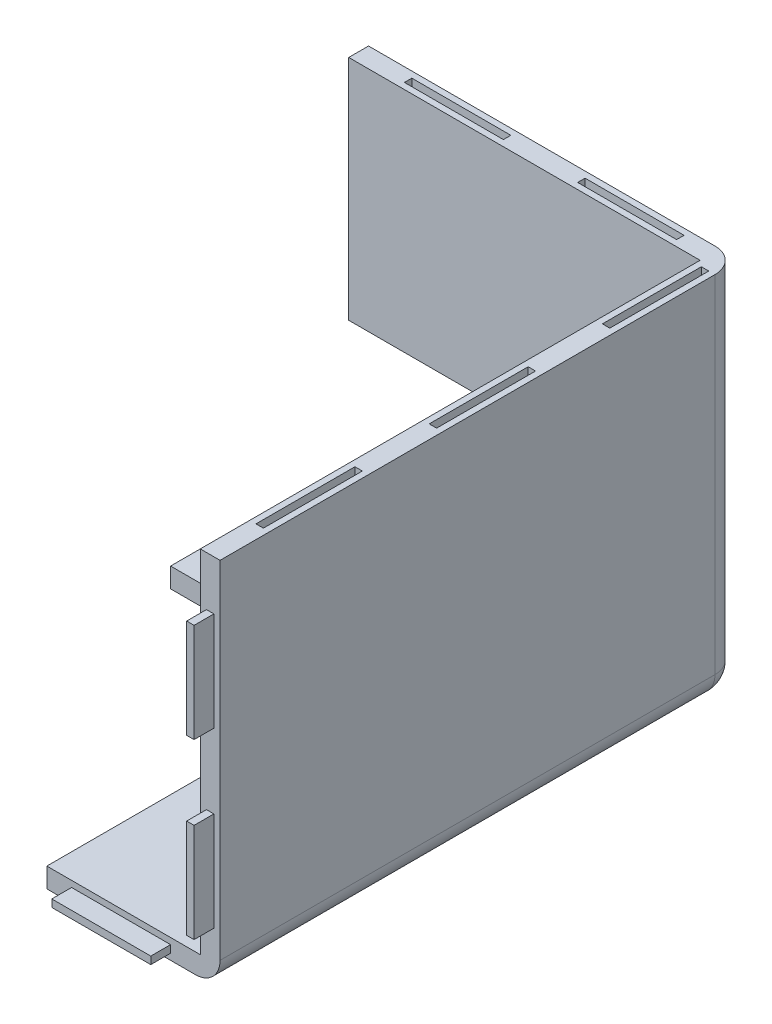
SolidWorks part; units mm, degrees
ref_plane "Alzado" through (0, 0, 0) normal (0, 0, 1) x (1, 0, 0)
ref_plane "Planta" through (0, 0, 0) normal (0, 1, 0) x (1, 0, 0)
ref_plane "Vista lateral" through (0, 0, 0) normal (1, 0, 0) x (0, 0, -1)
sketch "Croquis1" plane through (0, 0, 0) normal (0, 1, 0) x (1, 0, 0)
  line L1 (0, 0) -> (150, 0)
  line L2 (0, 0) -> (0, 210)
  line L3 (0, 210) -> (150, 210)
  line L4 (150, 0) -> (150, 210)
  dimension "D1" = 150
  dimension "D2" = 210
extrude "Saliente-Extruir1" add sketch "Croquis1" along normal blind 150
sketch "Croquis2" plane through (0, 150, 0) normal (0, 1, 0) x (1, 0, 0)
  line L1 (0, 202) -> (142, 202)
  line L2 (0, 202) -> (0, 0)
  line L3 (0, 0) -> (142, 0)
  line L4 (142, 202) -> (142, 0)
  line L5 (150, 210) -> (0, 210) construction
  line L8 (0, 0) -> (150, 0) construction
  line L9 (0, 210) -> (0, 0) construction
  line L10 (150, 0) -> (150, 210) construction
  dimension "D1" = 8
  dimension "D2" = 8
  dimension "D4" = 0
extrude "Cortar-Extruir1" cut sketch "Croquis2" against normal blind 142
sketch "Croquis8" plane through (0, 150, 0) normal (0, 1, 0) x (1, 0, 0)
  line L0 (0, 210) -> (0, 202) construction
  line L1 (20, 207.5) -> (60, 207.5)
  line L2 (20, 207.5) -> (20, 204.5)
  line L3 (20, 204.5) -> (60, 204.5)
  line L4 (60, 207.5) -> (60, 204.5)
  line L5 (90, 207.5) -> (130, 207.5)
  line L6 (90, 207.5) -> (90, 204.5)
  line L7 (90, 204.5) -> (130, 204.5)
  line L8 (130, 207.5) -> (130, 204.5)
  line L9 (150, 210) -> (0, 210) construction
  line L10 (142, 0) -> (150, 0) construction
  line L11 (144.5, 20) -> (147.5, 20)
  line L12 (144.5, 20) -> (144.5, 60)
  line L13 (144.5, 60) -> (147.5, 60)
  line L14 (147.5, 20) -> (147.5, 60)
  line L15 (144.5, 90) -> (147.5, 90)
  line L16 (144.5, 90) -> (144.5, 130)
  line L17 (144.5, 130) -> (147.5, 130)
  line L18 (147.5, 90) -> (147.5, 130)
  line L19 (144.5, 160) -> (147.5, 160)
  line L20 (144.5, 160) -> (144.5, 200)
  line L21 (144.5, 200) -> (147.5, 200)
  line L22 (147.5, 160) -> (147.5, 200)
  line L23 (150, 0) -> (150, 210) construction
  dimension "D1" = 3
  dimension "D2" = 3
  dimension "D3" = 20
  dimension "D4" = 40
  dimension "D5" = 30
  dimension "D6" = 40
  dimension "D7" = 2.5
  dimension "D8" = 2.5
  dimension "D9" = 40
  dimension "D10" = 40
  dimension "D11" = 40
  dimension "D12" = 20
  dimension "D13" = 30
  dimension "D14" = 30
  dimension "D15" = 3
  dimension "D16" = 3
  dimension "D17" = 3
  dimension "D18" = 2.5
  dimension "D19" = 2.5
  dimension "D20" = 2.5
sketch "Croquis9" plane through (0, 0, 0) normal (-1, 0, 0) x (0, 0, 1)
  line L0 (-210, 150) -> (-202, 150) construction
  line L1 (-207.5, 130) -> (-204.5, 130)
  line L2 (-207.5, 130) -> (-207.5, 90)
  line L3 (-207.5, 90) -> (-204.5, 90)
  line L4 (-204.5, 130) -> (-204.5, 90)
  line L9 (-20, 5.5) -> (-60, 5.5)
  line L10 (-20, 5.5) -> (-20, 2.5)
  line L11 (-20, 2.5) -> (-60, 2.5)
  line L12 (-60, 5.5) -> (-60, 2.5)
  line L13 (-90, 5.5) -> (-130, 5.5)
  line L14 (-90, 5.5) -> (-90, 2.5)
  line L15 (-90, 2.5) -> (-130, 2.5)
  line L16 (-130, 5.5) -> (-130, 2.5)
  line L17 (-160, 5.5) -> (-200, 5.5)
  line L18 (-160, 5.5) -> (-160, 2.5)
  line L19 (-160, 2.5) -> (-200, 2.5)
  line L20 (-200, 5.5) -> (-200, 2.5)
  line L21 (0, 8) -> (0, 0) construction
  line L22 (-210, 0) -> (0, 0) construction
  line L23 (-210, 150) -> (-210, 0) construction
  dimension "D1" = 40
  dimension "D4" = 20
  dimension "D5" = 40
  dimension "D6" = 40
  dimension "D7" = 40
  dimension "D8" = 30
  dimension "D9" = 30
  dimension "D10" = 20
  dimension "D11" = 3
  dimension "D12" = 3
  dimension "D13" = 3
  dimension "D14" = 2.5
  dimension "D15" = 2.5
  dimension "D16" = 2.5
  dimension "D18" = 3
  dimension "D19" = 2.5
extrude "Cortar-Extruir5" cut sketch "Croquis9" against normal blind 8
sketch "Croquis10" plane through (0, 0, 0) normal (0, 0, 1) x (1, 0, 0)
  line L0 (142, 150) -> (150, 150) construction
  line L1 (144.5, 130) -> (147.5, 130)
  line L2 (144.5, 130) -> (144.5, 90)
  line L3 (144.5, 90) -> (147.5, 90)
  line L4 (147.5, 130) -> (147.5, 90)
  line L5 (144.5, 60) -> (147.5, 60)
  line L6 (144.5, 60) -> (144.5, 20)
  line L7 (144.5, 20) -> (147.5, 20)
  line L8 (147.5, 60) -> (147.5, 20)
  line L9 (20, 5.5) -> (60, 5.5)
  line L10 (20, 5.5) -> (20, 2.5)
  line L11 (20, 2.5) -> (60, 2.5)
  line L12 (60, 5.5) -> (60, 2.5)
  line L13 (90, 5.5) -> (130, 5.5)
  line L14 (90, 5.5) -> (90, 2.5)
  line L15 (90, 2.5) -> (130, 2.5)
  line L16 (130, 5.5) -> (130, 2.5)
  line L17 (150, 150) -> (150, 0) construction
  line L18 (0, 8) -> (0, 0) construction
  line L19 (0, 0) -> (150, 0) construction
  dimension "D1" = 40
  dimension "D2" = 40
  dimension "D3" = 20
  dimension "D4" = 30
  dimension "D5" = 3
  dimension "D6" = 3
  dimension "D7" = 2.5
  dimension "D8" = 2.5
  dimension "D9" = 40
  dimension "D10" = 40
  dimension "D11" = 30
  dimension "D12" = 20
  dimension "D13" = 3
  dimension "D14" = 3
  dimension "D15" = 2.5
  dimension "D16" = 2.5
extrude "Saliente-Extruir6" add sketch "Croquis10" along normal blind 8
fillet "Redondeo2" radius 10 3 edges at (75, 0, -210) (150, 0, -105) (150, 75, -210)
sketch "Croquis11" plane through (0, 0, 0) normal (0, -1, 0) x (1, 0, 0)
  line L0 (20, 8) -> (60, 8) construction
  line L1 (0, 8) -> (80, 8)
  line L2 (0, 8) -> (0, -130)
  line L3 (0, -130) -> (80, -130)
  line L4 (80, 8) -> (80, -130)
  line L5 (0, -200) -> (0, 0) construction
  dimension "D1" = 80
  dimension "D2" = 138
extrude "Cortar-Extruir6" cut sketch "Croquis11" against normal blind 10
extrude "Cortar-Extruir7" cut sketch "Croquis8" against normal blind 10
sketch "Croquis12" plane through (0, 0, -210) normal (0, 0, -1) x (-1, 0, 0)
  line L0 (0, 150) -> (0, 10) construction
  line L1 (-50, 58) -> (0, 58)
  line L2 (-50, 58) -> (-50, 8)
  line L3 (-50, 8) -> (0, 8)
  line L4 (0, 58) -> (0, 8)
  line L5 (0, 0) -> (-140, 0) construction
  dimension "D1" = 8
  dimension "D2" = 50
  dimension "D3" = 50
extrude "Cortar-Extruir8" cut sketch "Croquis12" against normal blind 10
sketch "Croquis13" plane through (0, 0, -210) normal (0, 0, -1) x (-1, 0, 0)
  line L0 (0, 150) -> (0, 58) construction
  line L1 (-43, 63.5) -> (-28, 63.5)
  line L2 (-43, 63.5) -> (-43, 60.5)
  line L3 (-43, 60.5) -> (-28, 60.5)
  line L4 (-28, 63.5) -> (-28, 60.5)
  line L5 (-20, 63.5) -> (-5, 63.5)
  line L6 (-20, 63.5) -> (-20, 60.5)
  line L7 (-20, 60.5) -> (-5, 60.5)
  line L8 (-5, 63.5) -> (-5, 60.5)
  line L9 (-52.5, 51) -> (-55.5, 51)
  line L10 (-52.5, 51) -> (-52.5, 36)
  line L11 (-52.5, 36) -> (-55.5, 36)
  line L12 (-55.5, 51) -> (-55.5, 36)
  line L13 (-52.5, 28) -> (-55.5, 28)
  line L14 (-52.5, 28) -> (-52.5, 13)
  line L15 (-52.5, 13) -> (-55.5, 13)
  line L16 (-55.5, 28) -> (-55.5, 13)
  line L17 (-50, 8) -> (0, 8) construction
  line L18 (0, 58) -> (-50, 58) construction
  line L19 (-50, 58) -> (-50, 10) construction
  point P18 (-54, 13)
  point P21 (-54, 28)
  dimension "D1" = 3
  dimension "D2" = 3
  dimension "D3" = 3
  dimension "D4" = 3
  dimension "D5" = 15
  dimension "D6" = 15
  dimension "D7" = 5
  dimension "D8" = 8
  dimension "D9" = 5
  dimension "D10" = 15
  dimension "D11" = 15
  dimension "D12" = 8
  dimension "D13" = 2.5
  dimension "D14" = 2.5
  dimension "D15" = 2.5
  dimension "D16" = 2.5
extrude "Cortar-Extruir9" cut sketch "Croquis13" against normal blind 6
